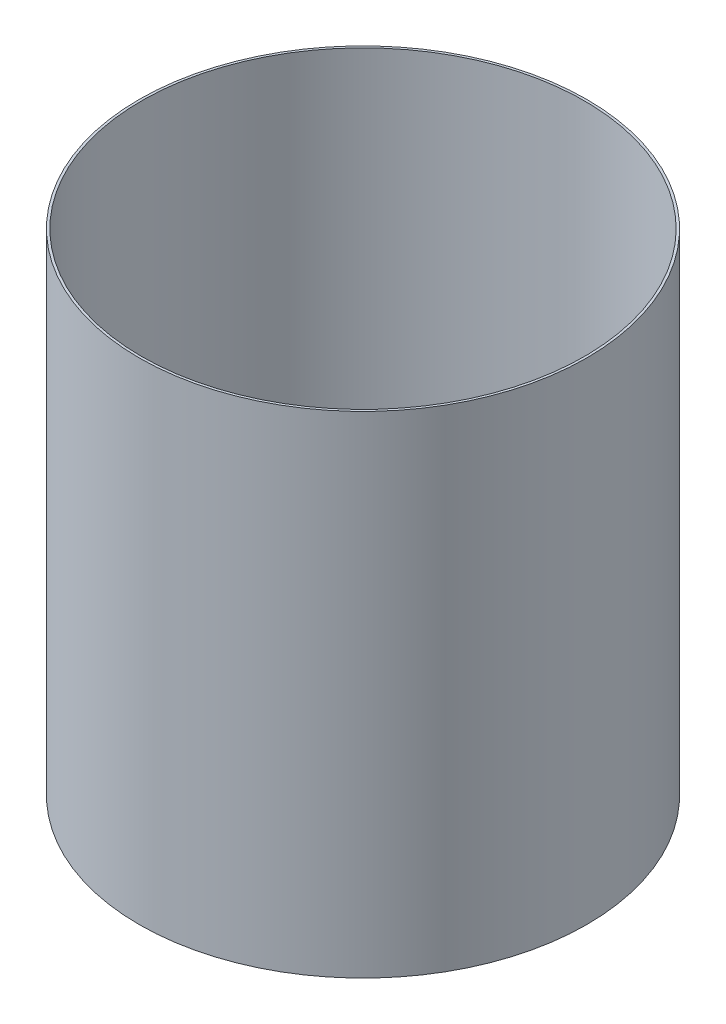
SolidWorks part; units mm, degrees
ref_plane "Plan de face" through (0, 0, 0) normal (0, 0, 1) x (1, 0, 0)
ref_plane "Plan de dessus" through (0, 0, 0) normal (0, 1, 0) x (1, 0, 0)
ref_plane "Plan de droite" through (0, 0, 0) normal (1, 0, 0) x (0, 0, -1)
sketch "Esquisse1" plane through (0, 0, 0) normal (0, 0, 1) x (1, 0, 0)
  line L0 (0, 87.6488) -> (0, -177.4831) construction
  line L2 (-92.5, 69.5301) -> (-92.5, -135.4699)
  line L5 (-91.5, 68.5301) -> (-91.5, -134.4699)
  line L7 (92.5, 69.5301) -> (-92.5, 69.5301) construction
  line L8 (92.5, 68.5301) -> (-91.5, 68.5301) construction
  line L9 (-92.5, -135.4699) -> (0, -135.4699) construction
  line L10 (-91.5, -134.4699) -> (0, -134.4699) construction
  dimension "D1" = 92.5
  dimension "D2" = 205
  dimension "D3" = 1
revolve "Révol.-Mince2" add sketch "Esquisse1" angle 360 about L0
